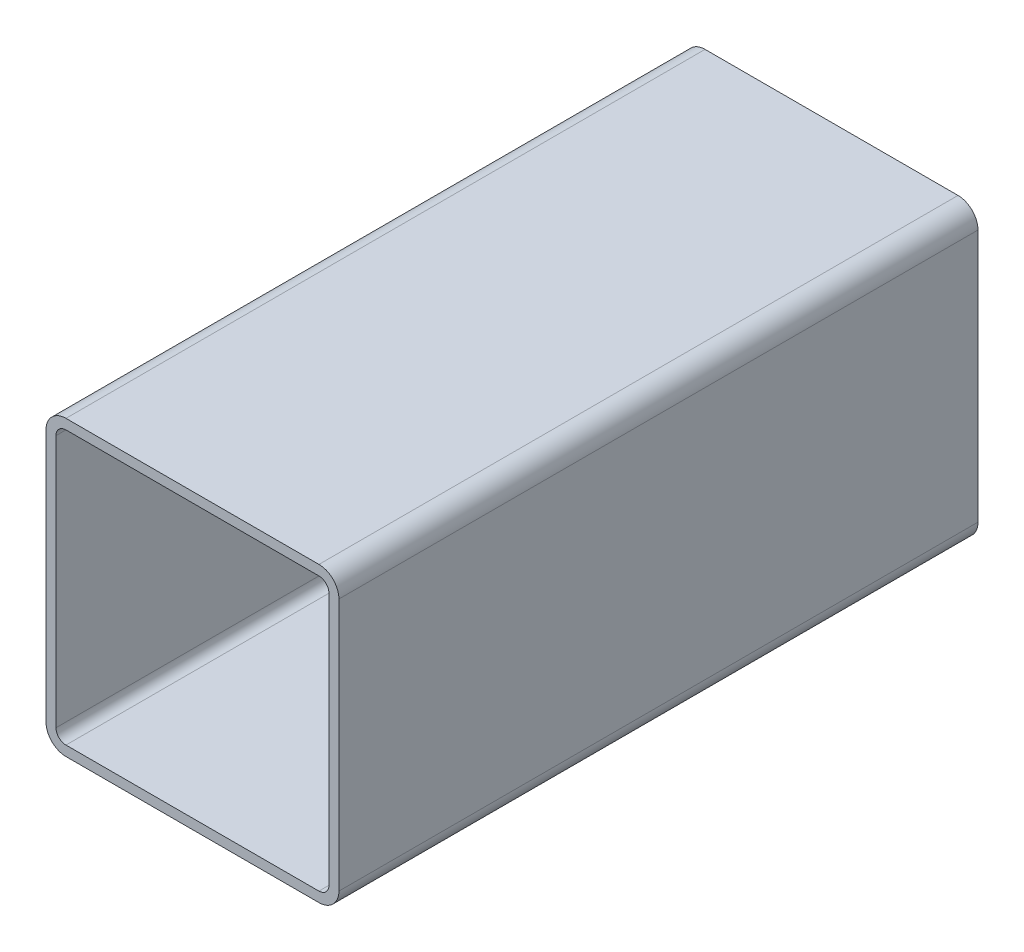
SolidWorks part; units mm, degrees
ref_plane "Front Plane" through (0, 0, 0) normal (0, 0, 1) x (1, 0, 0)
ref_plane "Top Plane" through (0, 0, 0) normal (0, 1, 0) x (1, 0, 0)
ref_plane "Right Plane" through (0, 0, 0) normal (1, 0, 0) x (0, 0, -1)
sketch "Sketch1" plane through (0, 0, 0) normal (0, 0, 1) x (1, 0, 0)
sketch_block_instance "HSS5.5x5.5x0.1875-1"
sketch_block "HSS5.5x5.5x0.1875"
extrude "Boss-Extrude1" add sketch "Sketch1" along normal blind 304.8
